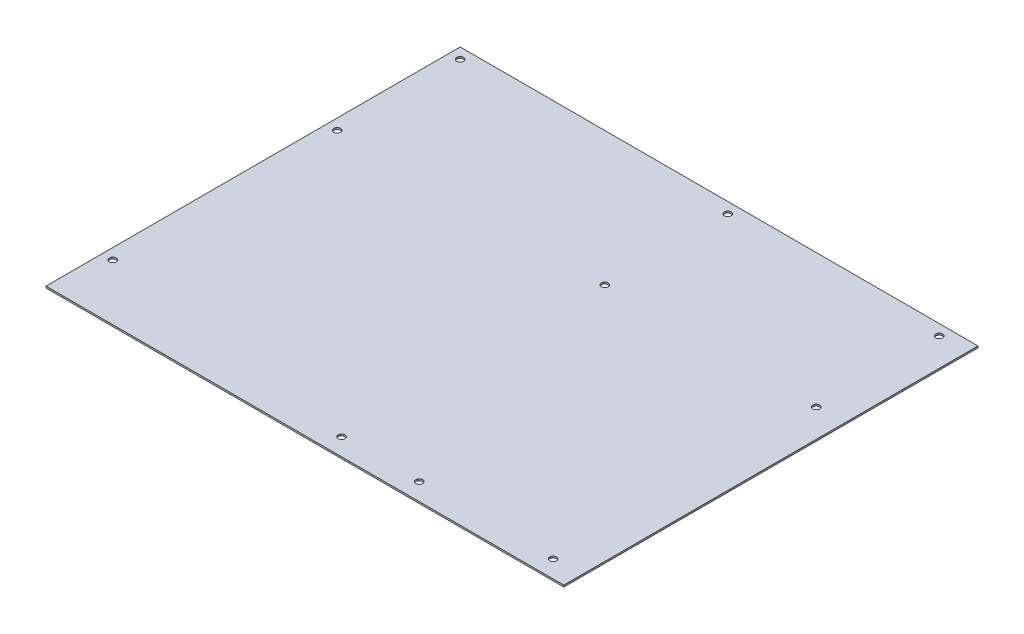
SolidWorks part; units mm, degrees
ref_plane "Front Plane" through (0, 0, 0) normal (0, 0, 1) x (1, 0, 0)
ref_plane "Top Plane" through (0, 0, 0) normal (0, 1, 0) x (1, 0, 0)
ref_plane "Right Plane" through (0, 0, 0) normal (1, 0, 0) x (0, 0, -1)
sketch "Sketch1" plane through (0, 0, 0) normal (0, 1, 0) x (1, 0, 0)
  line L1 (0, 0) -> (-304.8, 0)
  line L2 (0, 0) -> (0, 243.8)
  line L3 (0, 243.8) -> (-304.8, 243.8)
  line L4 (-304.8, 0) -> (-304.8, 243.8)
  dimension "D1" = 243.8
  dimension "D2" = 304.8
extrude "Boss-Extrude1" add sketch "Sketch1" along normal blind 1
sketch "Sketch2" plane through (0, 1, 0) normal (0, 1, 0) x (1, 0, 0)
  line L0 (-304.8, 0) -> (0, 0) construction
  line L1 (-16.5, 237.5) -> (-16.5, 165.1) construction
  line L2 (-16.5, 165.1) -> (-16.5, 10.2) construction
  line L3 (0, 0) -> (0, 243.8) construction
  line L4 (-95.3, 0) -> (-95.3, 243.8) construction
  line L5 (0, 243.8) -> (-304.8, 243.8) construction
  line L6 (-141, 243.8) -> (-141, 0) construction
  line L7 (-298.5, 243.8) -> (-298.5, 0) construction
  line L8 (-16.5, 10.2) -> (-298.5, 10.2) construction
  line L9 (-16.5, 165.1) -> (-298.5, 165.1) construction
  line L10 (-16.5, 237.5) -> (-298.5, 237.5) construction
  line L11 (0, 33) -> (-304.8, 33) construction
  line L12 (-304.8, 243.8) -> (-304.8, 0) construction
  circle A0 centre (-16.5, 237.5) radius 2
  circle A1 centre (-16.5, 165.1) radius 2
  circle A2 centre (-16.5, 10.2) radius 2
  circle A3 centre (-298.5, 165.1) radius 2
  circle A4 centre (-298.5, 237.5) radius 2
  circle A5 centre (-141, 237.5) radius 2
  circle A6 centre (-141, 165.1) radius 2
  circle A7 centre (-141, 10.2) radius 2
  circle A8 centre (-95.3, 10.2) radius 2
  circle A9 centre (-298.5, 33) radius 2
  dimension "D1" = 237.5
  dimension "D2" = 4
  dimension "D4" = 10.2
  dimension "D3" = 165.1
  dimension "D5" = 16.5
  dimension "D6" = 95.3
  dimension "D7" = 141
  dimension "D8" = 298.5
  dimension "D9" = 33
extrude "Cut-Extrude1" cut sketch "Sketch2" against normal blind 1
